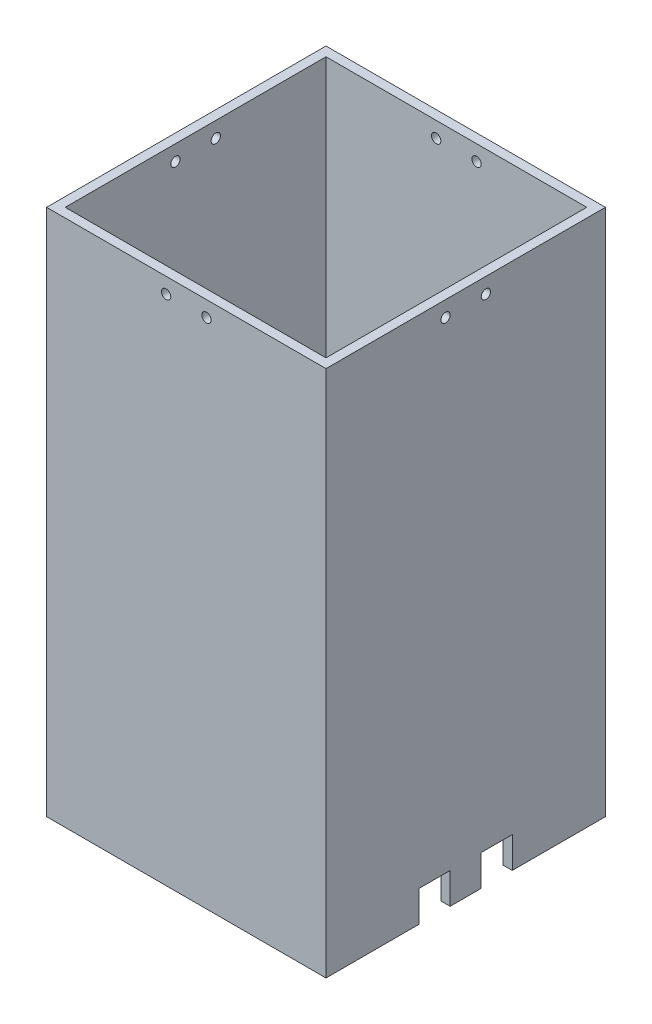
SolidWorks part; units mm, degrees
ref_plane "Front" through (0, 0, 0) normal (0, 0, 1) x (1, 0, 0)
ref_plane "Top" through (0, 0, 0) normal (0, 1, 0) x (1, 0, 0)
ref_plane "Right" through (0, 0, 0) normal (1, 0, 0) x (0, 0, -1)
sketch "草图1" plane through (0, 0, 0) normal (0, 1, 0) x (1, 0, 0)
  line L0 (-42, 42) -> (-42, -42)
  line L1 (-45, -45) -> (45, -45)
  line L2 (-45, -45) -> (-45, 45)
  line L3 (-45, 45) -> (45, 45)
  line L4 (45, -45) -> (45, 45)
  line L5 (-45, -45) -> (45, 45) construction
  line L6 (-45, 45) -> (45, -45) construction
  line L7 (-42, -42) -> (42, -42)
  line L8 (42, -42) -> (42, 42)
  line L9 (42, 42) -> (-42, 42)
  point P0 (0, 0)
  dimension "D1" = 90
  dimension "D2" = 90
  dimension "D3" = 3
extrude "凸台-拉伸1" add sketch "草图1" along normal blind 170
sketch "草图2" plane through (0, 0, 45) normal (0, 0, 1) x (1, 0, 0)
  line L0 (45, 170) -> (45, 0) construction
  line L1 (-45, 170) -> (45, 170) construction
  circle A0 centre (6.5, 165) radius 1.5
  circle A1 centre (-6.5, 165) radius 1.5
  dimension "D3" = 3
  dimension "D4" = 3
  dimension "D1" = 13
  dimension "D2" = 38.5
  dimension "D5" = 5
  dimension "D6" = 5
extrude "切除-拉伸1" cut sketch "草图2" against normal up to surface (90 mm away)
sketch "草图3" plane through (45, 0, 0) normal (1, 0, 0) x (0, 0, -1)
  line L0 (45, 170) -> (45, 0) construction
  line L1 (-45, 170) -> (45, 170) construction
  circle A0 centre (6.5, 165) radius 1.5
  circle A1 centre (-6.5, 165) radius 1.5
  dimension "D2" = 38.5
  dimension "D3" = 5
  dimension "D5" = 3
  dimension "D6" = 3
  dimension "D1" = 13
  dimension "D4" = 5
extrude "切除-拉伸2" cut sketch "草图3" against normal up to surface (90 mm away)
sketch "草图4" plane through (45, 0, 0) normal (1, 0, 0) x (0, 0, -1)
  line L1 (5, 0) -> (15, 0)
  line L2 (5, 0) -> (5, 10)
  line L3 (5, 10) -> (15, 10)
  line L4 (15, 0) -> (15, 10)
  line L5 (-15, 0) -> (-5, 0)
  line L6 (-15, 0) -> (-15, 10)
  line L7 (-15, 10) -> (-5, 10)
  line L8 (-5, 0) -> (-5, 10)
extrude "切除-拉伸3" cut sketch "草图4" against normal up to surface (90 mm away)
